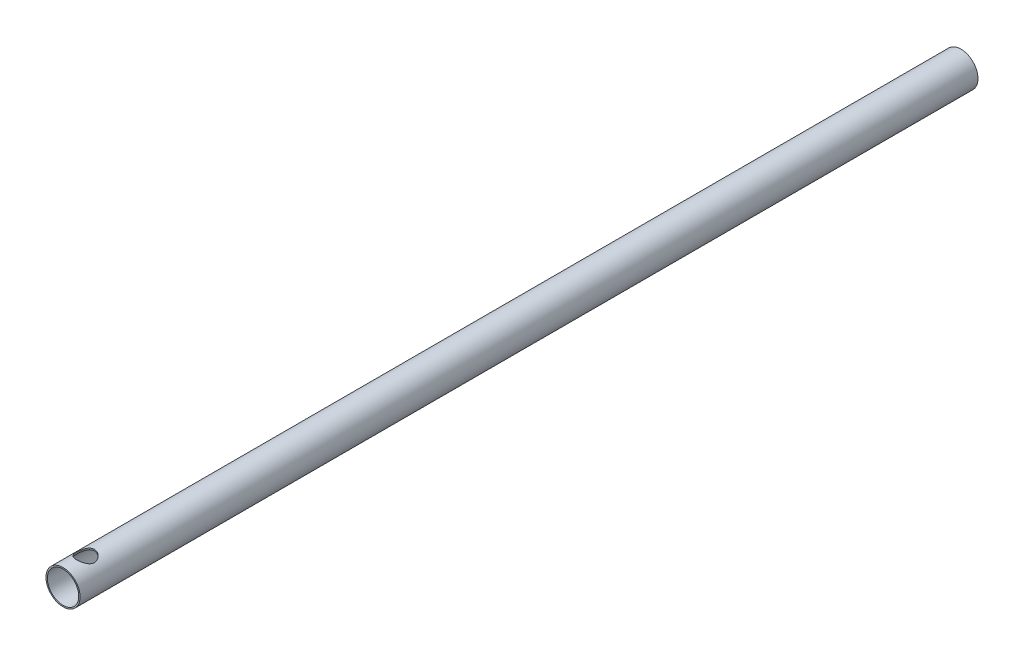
SolidWorks part; units mm, degrees
ref_plane "Front Plane" through (0, 0, 0) normal (0, 0, 1) x (1, 0, 0)
ref_plane "Top Plane" through (0, 0, 0) normal (0, 1, 0) x (1, 0, 0)
ref_plane "Right Plane" through (0, 0, 0) normal (1, 0, 0) x (0, 0, -1)
sketch "Sketch1" plane through (0, 0, 0) normal (0, 0, 1) x (1, 0, 0)
  circle A0 centre (0, 0) radius 35
  circle A1 centre (0, 0) radius 38
extrude "Extrude1" add sketch "Sketch1" along normal blind 2000
ref_plane "Plane1" through (0, 0, 0) normal (0, 1, 0) x (-1, 0, 0)
sketch "Sketch2" plane through (0, 0, 0) normal (0, 1, 0) x (-1, 0, 0)
  circle A0 centre (0, 50) radius 20
  dimension "D1" = 50
extrude "Cut-Extrude1" cut sketch "Sketch2" against normal blind 60
sketch "Sketch3" plane through (0, 0, 0) normal (0, 1, 0) x (-1, 0, 0)
  line L0 (38, 2000) -> (-38, 2000) construction
  circle A0 centre (0, 1950) radius 20
  dimension "D1" = 50
extrude "Cut-Extrude2" cut sketch "Sketch3" along normal blind 60
